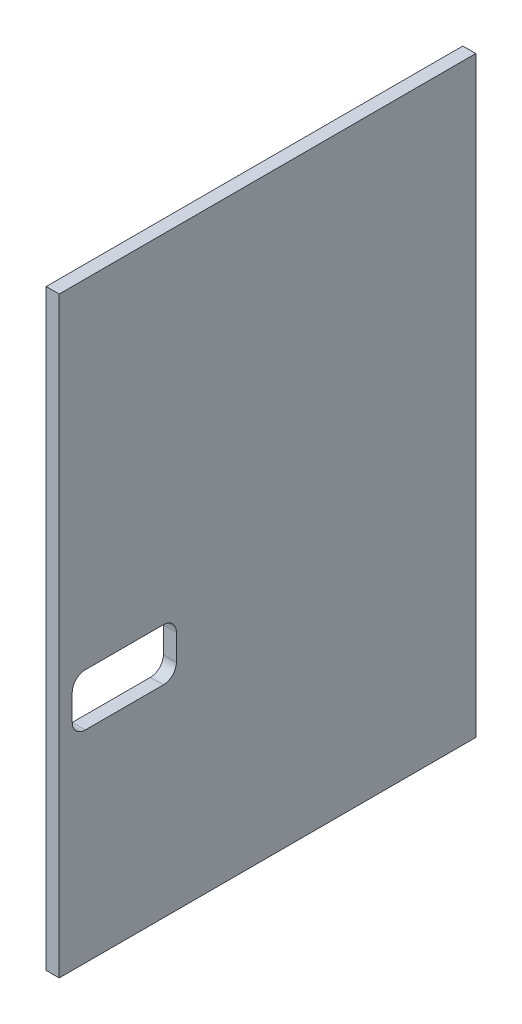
SolidWorks part; units mm, degrees
ref_plane "Front Plane" through (0, 0, 0) normal (0, 0, 1) x (1, 0, 0)
ref_plane "Top Plane" through (0, 0, 0) normal (0, 1, 0) x (1, 0, 0)
ref_plane "Right Plane" through (0, 0, 0) normal (1, 0, 0) x (0, 0, -1)
sketch "Sketch1" plane through (0, 0, 0) normal (1, 0, 0) x (0, 0, -1)
  line L1 (0, 0) -> (812.8, 0)
  line L2 (0, 0) -> (0, 1155.7)
  line L3 (0, 1155.7) -> (812.8, 1155.7)
  line L4 (812.8, 0) -> (812.8, 1155.7)
  dimension "D1" = 812.8
  dimension "D2" = 1155.7
extrude "Boss-Extrude1" add sketch "Sketch1" along normal blind 25.4
sketch "Sketch3" plane through (25.4, 0, 0) normal (1, 0, 0) x (0, 0, -1)
  line L0 (0, 1155.7) -> (0, 0) construction
  line L1 (50.8, 495.3) -> (203.2, 495.3)
  line L2 (25.4, 469.9) -> (25.4, 419.1)
  line L3 (50.8, 393.7) -> (203.2, 393.7)
  line L4 (228.6, 469.9) -> (228.6, 419.1)
  line L5 (-398.9157, 495.3) -> (1315.5843, 495.3) construction
  arc A0 (203.2, 495.3) -> (228.6, 469.9) centre (203.2, 469.9) cw
  arc A1 (203.2, 393.7) -> (228.6, 419.1) centre (203.2, 419.1) ccw
  arc A2 (25.4, 419.1) -> (50.8, 393.7) centre (50.8, 419.1) ccw
  arc A3 (50.8, 495.3) -> (25.4, 469.9) centre (50.8, 469.9) ccw
  dimension "D3" = 25.4
  dimension "D1" = 203.2
  dimension "D2" = 101.6
  dimension "D4" = 25.4
extrude "Cut-Extrude1" cut sketch "Sketch3" against normal up to next
